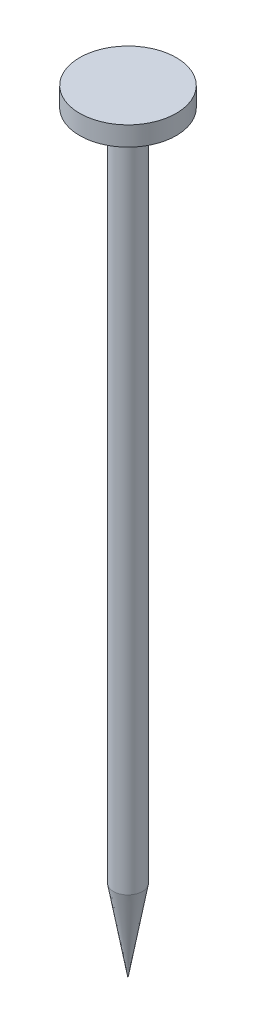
SolidWorks part; units mm, degrees
ref_plane "Ebene vorne" through (0, 0, 0) normal (0, 0, 1) x (1, 0, 0)
ref_plane "Ebene oben" through (0, 0, 0) normal (0, 1, 0) x (1, 0, 0)
ref_plane "Ebene rechts" through (0, 0, 0) normal (1, 0, 0) x (0, 0, -1)
sketch "Skizze1" plane through (0, 0, 0) normal (0, 0, 1) x (1, 0, 0)
  line L0 (0, 0) -> (0.75, 4.2535)
  line L1 (0.75, 4.2535) -> (0.75, 39)
  line L2 (0.75, 39) -> (2.5, 39)
  line L3 (2.5, 39) -> (2.5, 40)
  line L4 (2.5, 40) -> (0, 40)
  line L5 (0, 40) -> (0, 0)
  line L6 (0, 0) -> (0, -29.4163) construction
  dimension "Kopfhöhe" = 1
  dimension "Länge" = 40
  dimension "Draht-D" = 1.5
  dimension "Kopf-D" = 5
  dimension "D5" = 10
revolve "Rotation1" add sketch "Skizze1" angle 360 about L6
